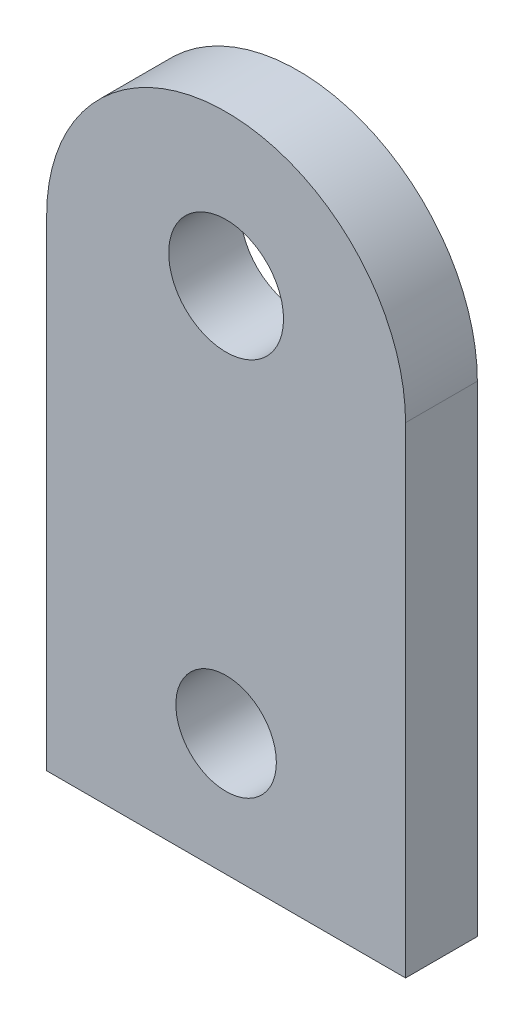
SolidWorks part; units mm, degrees
ref_plane "Plan de face" through (0, 0, 0) normal (0, 0, 1) x (1, 0, 0)
ref_plane "Plan de dessus" through (0, 0, 0) normal (0, 1, 0) x (1, 0, 0)
ref_plane "Plan de droite" through (0, 0, 0) normal (1, 0, 0) x (0, 0, -1)
sketch "Esquisse1" plane through (0, 0, 0) normal (0, 0, 1) x (1, 0, 0)
  line L0 (-12.5, 0) -> (12.5, 0)
  line L1 (12.5, 0) -> (12.5, 33.5)
  line L2 (-12.5, 33.5) -> (-12.5, 0)
  arc A0 (12.5, 33.5) -> (-12.5, 33.5) centre (0, 33.5) ccw
  point P6 (0, 0)
  dimension "D2" = 46
  dimension "D1" = 25
extrude "Boss.-Extru.1" add sketch "Esquisse1" along normal blind 5
hole_wizard "Diamètre du perçage Ø8.0 (8)1" positions "Esquisse3" profile "Esquisse2" hole size "Ø8.0" standard "ISO"
sketch "Esquisse3" plane through (0, 0, 5) normal (0, 0, 1) x (1, 0, 0)
  arc A0 (12.5, 33.5) -> (-12.5, 33.5) centre (0, 33.5) ccw construction
  point P0 (0, 35.5)
  dimension "D1" = 2
sketch "Esquisse2" plane through (0, 35.5, 5) normal (1, 0, 0) x (0, -1, 0)
  line L0 (0, 0) -> (0, 5)
  line L1 (0, 5) -> (4, 5)
  line L2 (4, 5) -> (4, 0)
  line L5 (4, 0) -> (0, 0)
  line L11 (0, -6.35) -> (0, 107.95) construction
  dimension "Diamètre du perçage jusqu'au prochain" = 8
  dimension "Profondeur du perçage jusqu'au prochain" = 5
sketch "Esquisse4" plane through (0, 0, 5) normal (0, 0, 1) x (1, 0, 0)
  line L0 (-12.5, 0) -> (12.5, 0) construction
  circle A0 centre (0, 8.5) radius 3.5
  dimension "D1" = 7
  dimension "D2" = 8.5
extrude "Enlèv. mat.-Extru.1" cut sketch "Esquisse4" against normal through all
